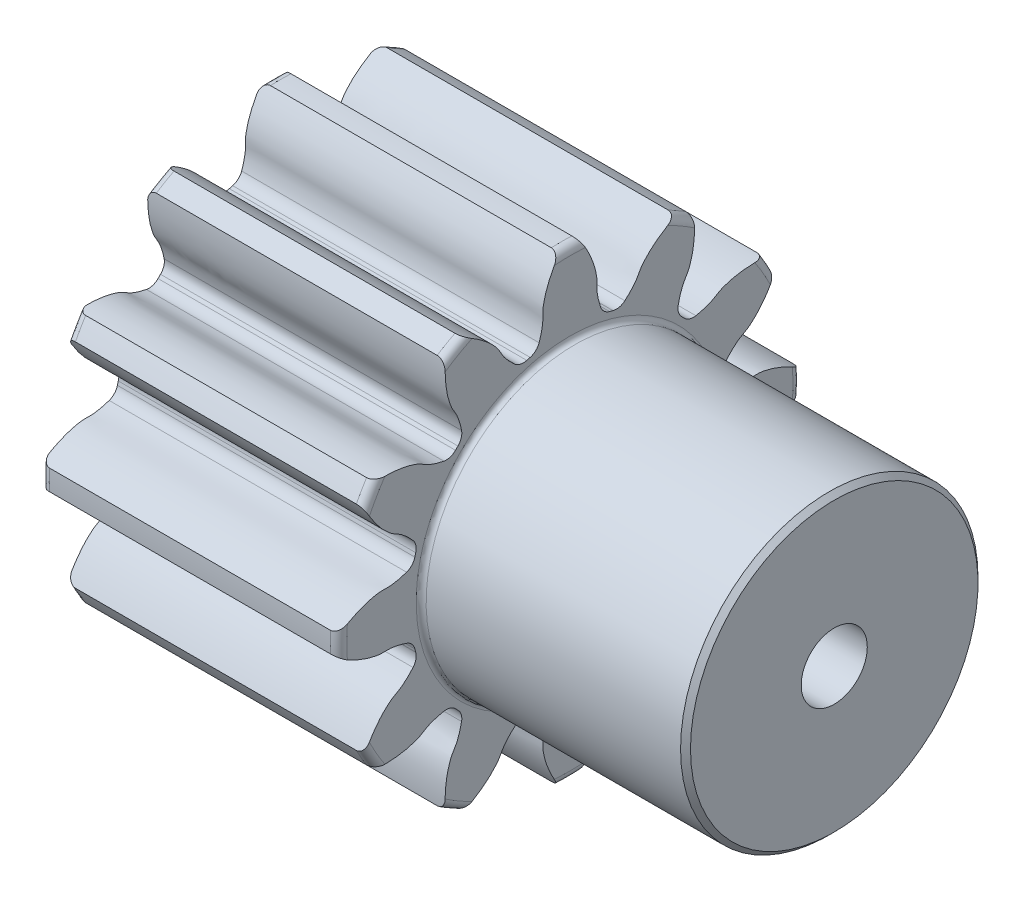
SolidWorks part; units mm, degrees
ref_plane "Front Plane" through (0, 0, 0) normal (0, 0, 1) x (1, 0, 0)
ref_plane "Top Plane" through (0, 0, 0) normal (0, 1, 0) x (1, 0, 0)
ref_plane "Right Plane" through (0, 0, 0) normal (1, 0, 0) x (0, 0, -1)
imported_body "Imported1"
sketch "Sketch1" plane through (12.5, 0, 0) normal (1, 0, 0) x (0, 0, -1)
  circle A0 centre (0, 0) radius 1
  circle A1 centre (0, 0) radius 2.1
  dimension "D1" = 2
  dimension "D2" = 4.2
extrude "Extrude1" add sketch "Sketch1" against normal blind 7.85
